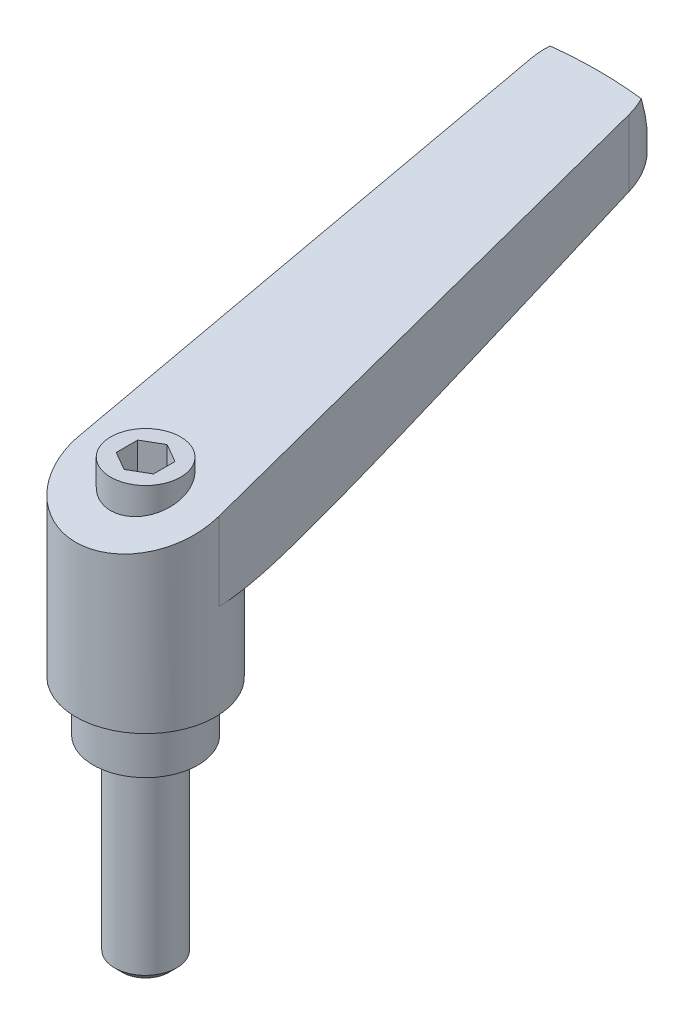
SolidWorks part; units mm, degrees
ref_plane "Ebene vorne" through (0, 0, 0) normal (0, 0, 1) x (1, 0, 0)
ref_plane "Ebene oben" through (0, 0, 0) normal (0, 1, 0) x (1, 0, 0)
ref_plane "Ebene rechts" through (0, 0, 0) normal (1, 0, 0) x (0, 0, -1)
imported_body "Importiert3"
sketch "Skizze1" plane through (0, 18.5386, 0) normal (0, -1, 0) x (1, 0, 0)
  circle A0 centre (0, 0) radius 9
extrude "Aufsatz-Linear austragen1" add sketch "Skizze1" along normal blind 12.0386
sketch "Skizze2" plane through (0, 6.5, 0) normal (0, -1, 0) x (1, 0, 0)
  circle A0 centre (0, 0) radius 6.75
extrude "Aufsatz-Linear austragen2" add sketch "Skizze2" along normal blind 6.5
sketch "Skizze3" plane through (0, 0, 0) normal (0, -1, 0) x (1, 0, 0)
  circle A0 centre (0, 0) radius 4
extrude "Aufsatz-Linear austragen3" add sketch "Skizze3" along normal blind 25
ref_plane "Ebene4" through (0, 31, 0) normal (0, 1, 0) x (-1, 0, 0)
sketch "Skizze4" plane through (0, 31, 0) normal (0, 1, 0) x (-1, 0, 0)
  circle A0 centre (0, 0) radius 4.5
extrude "Aufsatz-Linear austragen4" add sketch "Skizze4" against normal up to next
sketch "Skizze5" plane through (0, 31, 0) normal (0, 1, 0) x (-1, 0, 0)
  line L0 (-2.4, -1.3856) -> (0, -2.7713)
  line L1 (0, -2.7713) -> (2.4, -1.3856)
  line L2 (2.4, -1.3856) -> (2.4, 1.3856)
  line L3 (2.4, 1.3856) -> (0, 2.7713)
  line L4 (0, 2.7713) -> (-2.4, 1.3856)
  line L5 (-2.4, 1.3856) -> (-2.4, -1.3856)
extrude "Schnitt-Linear austragen1" cut sketch "Skizze5" against normal blind 4.8
chamfer "Fase1" distance 1 angle 45 1 edges at (0, -25, -4)
